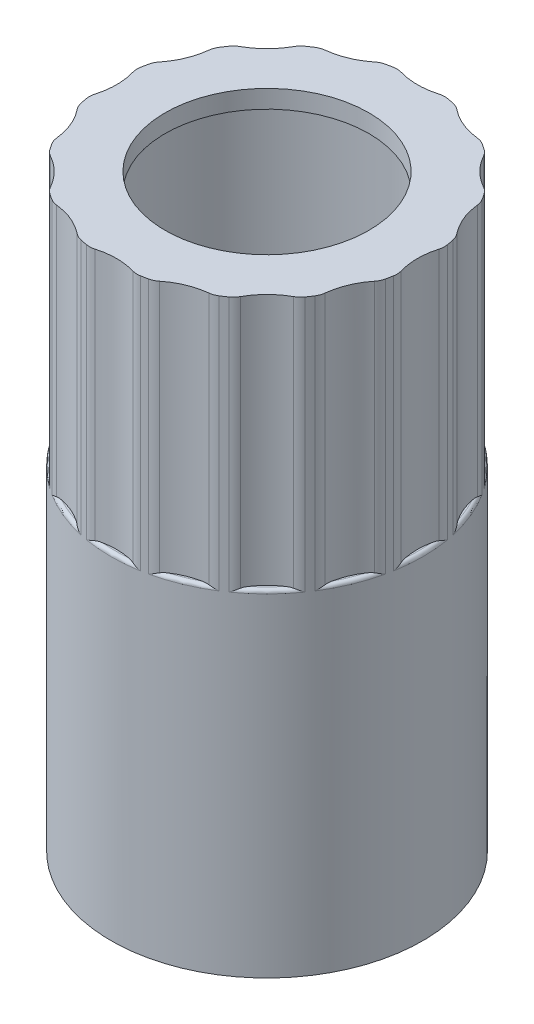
SolidWorks part; units mm, degrees
ref_plane "Front Plane" through (0, 0, 0) normal (0, 0, 1) x (1, 0, 0)
ref_plane "Top Plane" through (0, 0, 0) normal (0, 1, 0) x (1, 0, 0)
ref_plane "Right Plane" through (0, 0, 0) normal (1, 0, 0) x (0, 0, -1)
sketch "Sketch1" plane through (0, 0, 0) normal (0, 0, 1) x (1, 0, 0)
  line L0 (-9.73, 0) -> (-9.73, 40.23)
  line L1 (-9.73, 40.23) -> (-7.19, 40.23)
  line L2 (-7.19, 40.23) -> (-7.19, 41.5)
  line L3 (-7.19, 41.5) -> (-11, 41.5)
  line L4 (-11, 41.5) -> (-11, 0)
  line L5 (-11, 0) -> (-9.73, 0)
  line L6 (0, 0) -> (0, 27.671) construction
  dimension "D1" = 22
  dimension "D2" = 1.27
  dimension "D3" = 1.27
  dimension "D4" = 41.5
  dimension "D5" = 3.81
revolve "Revolve1" add sketch "Sketch1" angle 360 about L6
sketch "Sketch2" plane through (0, 41.5, 0) normal (0, 1, 0) x (1, 0, 0)
  line L0 (0, 0) -> (0, 10.6139) construction
  arc A0 (-1.3318, 10.8029) -> (1.3318, 10.8029) centre (0, 15.4022) ccw
  arc A3 (-1.3318, 10.8029) -> (-1.905, 10.8338) centre (-1.6851, 9.583) ccw
  circle A4 centre (0, 0) radius 11 construction
  arc A5 (1.3318, 10.8029) -> (1.905, 10.8338) centre (1.6851, 9.583) cw
  arc A6 (-1.905, 10.8338) -> (1.905, 10.8338) centre (0, 0) cw
  dimension "D1" = 3.81
  dimension "D2" = 4.7883
  dimension "D3" = 1.27
extrude "Cut-Extrude1" cut sketch "Sketch2" against normal blind 17.78
fillet "Fillet1" radius 0.254 1 edges at (0, 23.72, -11)
pattern_circular "CirPattern1" count 16 over 360 about axis through (0, 0, 0) along (0, 1, 0) of "Cut-Extrude1", "Fillet1"
